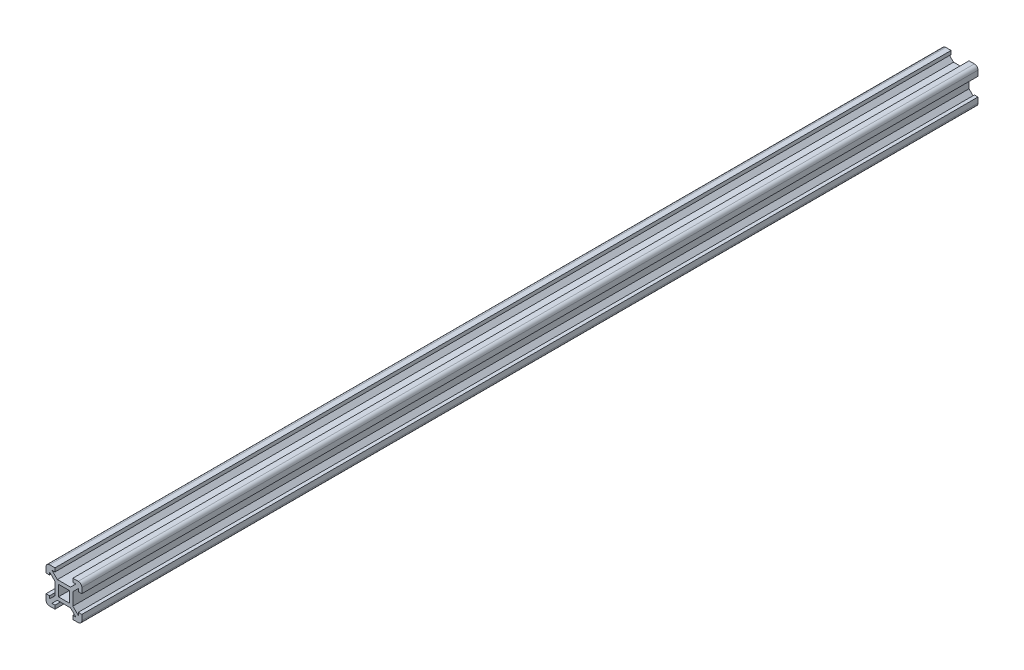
SolidWorks part; units mm, degrees
ref_plane "Plan de face" through (0, 0, 0) normal (0, 0, 1) x (1, 0, 0)
ref_plane "Plan de dessus" through (0, 0, 0) normal (0, 1, 0) x (1, 0, 0)
ref_plane "Plan de droite" through (0, 0, 0) normal (1, 0, 0) x (0, 0, -1)
sketch "Esquisse1" plane through (0, 0, 0) normal (0, 0, 1) x (1, 0, 0)
  line L0 (20, 10) -> (0, 10) construction
  line L1 (5, 13.5227) -> (5, 6.4773)
  line L2 (15, 15) -> (10, 10) construction
  line L3 (2, 20) -> (5, 20)
  line L4 (6.3502, 15) -> (3.3055, 18)
  line L5 (10, 20) -> (10, 0) construction
  line L6 (20, 15) -> (20, 18)
  line L7 (20, 15) -> (18, 15)
  line L8 (15, 20) -> (15, 18)
  line L9 (6.3502, 15) -> (13.6498, 15)
  line L10 (5, 5) -> (10, 10) construction
  line L11 (18, 16.4786) -> (18, 15)
  line L12 (5, 15) -> (10, 10) construction
  line L13 (3.3055, 18) -> (5, 18)
  line L14 (2, 16.4786) -> (2, 15)
  line L15 (16.6945, 18) -> (15, 18)
  line L16 (15, 5) -> (10, 10) construction
  line L17 (13.6498, 15) -> (16.6945, 18)
  line L18 (18, 20) -> (15, 20)
  line L19 (15, 13.5227) -> (15, 6.4773)
  line L21 (5, 13.5227) -> (2, 16.4786)
  line L22 (0, 5) -> (0, 2)
  line L23 (0, 5) -> (2, 5)
  line L24 (5, 0) -> (5, 2)
  line L25 (5, 6.4773) -> (2, 3.5214)
  line L26 (15, 6.4773) -> (18, 3.5214)
  line L27 (18, 0) -> (15, 0)
  line L28 (13.6498, 5) -> (16.6945, 2)
  line L29 (16.6945, 2) -> (15, 2)
  line L30 (5, 20) -> (5, 18)
  line L31 (2, 3.5214) -> (2, 5)
  line L32 (0, 15) -> (2, 15)
  line L33 (3.3055, 2) -> (5, 2)
  line L34 (18, 3.5214) -> (18, 5)
  line L35 (6.3502, 5) -> (13.6498, 5)
  line L36 (15, 0) -> (15, 2)
  line L37 (20, 5) -> (18, 5)
  line L38 (20, 5) -> (20, 2)
  line L39 (6.3502, 5) -> (3.3055, 2)
  line L40 (0, 15) -> (0, 18)
  line L41 (2, 0) -> (5, 0)
  line L42 (15, 13.5227) -> (18, 16.4786)
  line L43 (6.9573, 13.0427) -> (13.0427, 13.0427)
  line L44 (6.9573, 13.0427) -> (6.9573, 6.9573)
  line L45 (6.9573, 6.9573) -> (13.0427, 6.9573)
  line L46 (13.0427, 13.0427) -> (13.0427, 6.9573)
  line L47 (6.9573, 13.0427) -> (13.0427, 6.9573) construction
  line L48 (6.9573, 6.9573) -> (13.0427, 13.0427) construction
  arc A0 (0, 18) -> (2, 20) centre (2, 18) cw
  arc A1 (20, 18) -> (18, 20) centre (18, 18) ccw
  arc A2 (18, 0) -> (20, 2) centre (18, 2) ccw
  arc A3 (0, 2) -> (2, 0) centre (2, 2) ccw
  point P1 (10, 5)
  point P9 (10, 10)
  point P14 (10, 10)
  point P20 (10, 10)
  point P21 (10, 10)
  point P23 (10, 15)
  point P30 (0, 20)
  point P44 (15, 10)
  point P56 (5, 10)
  point P61 (-3.9158, 3.5214)
  point P63 (20, 20)
  point P66 (20, 0)
  point P69 (0, 0)
extrude "Extrusion1" add sketch "Esquisse1" along normal blind 500
